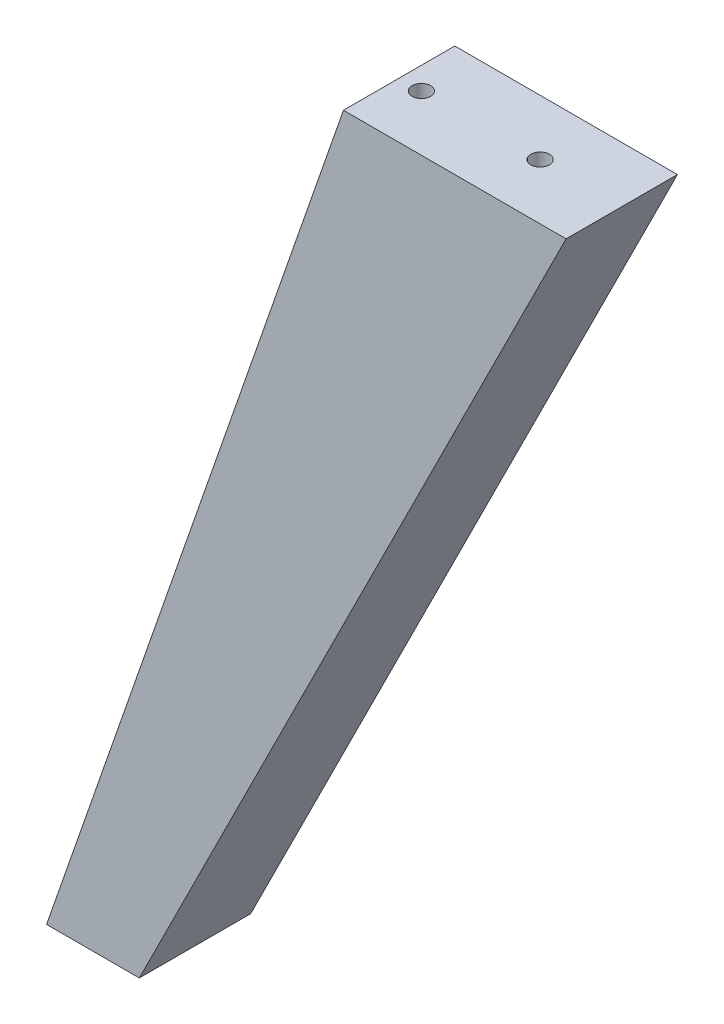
SolidWorks part; units mm, degrees
ref_plane "Plan de face" through (0, 0, 0) normal (0, 0, 1) x (1, 0, 0)
ref_plane "Plan de dessus" through (0, 0, 0) normal (0, 1, 0) x (1, 0, 0)
ref_plane "Plan de droite" through (0, 0, 0) normal (1, 0, 0) x (0, 0, -1)
sketch "Esquisse1" plane through (0, 0, 0) normal (0, 0, 1) x (1, 0, 0)
  line L0 (25, 0) -> (0, 0)
  line L1 (0, 0) -> (80, 230)
  line L2 (80, 230) -> (140, 230)
  line L3 (140, 230) -> (25, 0)
  dimension "D1" = 25
  dimension "D2" = 80
  dimension "D3" = 60
  dimension "D4" = 230
extrude "Boss.-Extru.1" add sketch "Esquisse1" along normal mid plane 30
sketch "Esquisse2" plane through (0, 230, 0) normal (0, 1, 0) x (1, 0, 0)
  line L0 (140, -15) -> (140, 15) construction
  circle A0 centre (118, 0) radius 2.5
  circle A1 centre (86, 0) radius 2.5
  dimension "D1" = 32
  dimension "D2" = 22
  dimension "D3" = 5
extrude "Enlèv. mat.-Extru.1" cut sketch "Esquisse2" against normal blind 25
